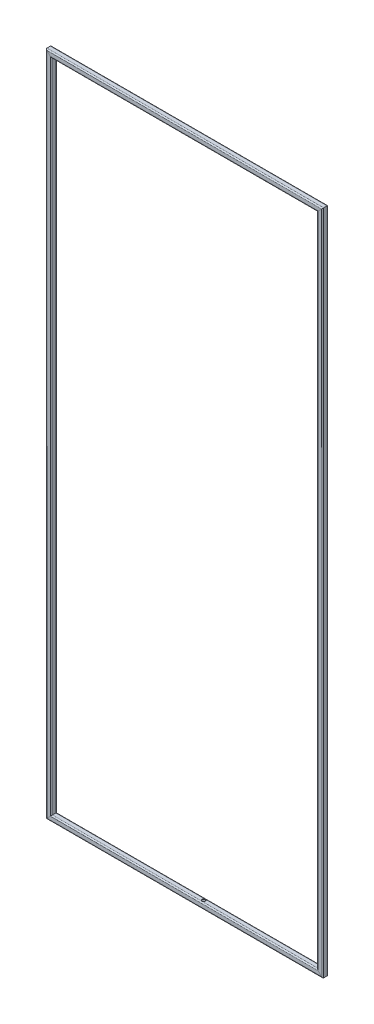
SolidWorks part; units mm, degrees
ref_plane "Piano frontale" through (0, 0, 0) normal (0, 0, 1) x (1, 0, 0)
ref_plane "Piano superiore" through (0, 0, 0) normal (0, 1, 0) x (1, 0, 0)
ref_plane "Piano destro" through (0, 0, 0) normal (1, 0, 0) x (0, 0, -1)
sketch "Schizzo1" plane through (0, 0, 0) normal (0, 0, 1) x (1, 0, 0)
  line L1 (490, -1195) -> (-490, -1195)
  line L2 (490, -1195) -> (490, 1195)
  line L3 (490, 1195) -> (-490, 1195)
  line L4 (-490, -1195) -> (-490, 1195)
  line L5 (490, -1195) -> (-490, 1195) construction
  line L6 (490, 1195) -> (-490, -1195) construction
  point P0 (0, 0)
  dimension "D1" = 980
  dimension "D2" = 2390
other "Tubo quadrato 20 X 20 X 2.0(1)"
ref_plane "Piano1" through (-490, -1195, 0) normal (0, 1, 0) x (-1, 0, 0)
sketch "Sketch1" plane through (-490, -1195, 0) normal (0, 1, 0) x (-1, 0, 0)
  line L0 (-6, -8) -> (6, -8)
  line L1 (-8, -6) -> (-8, 6)
  line L2 (6, 8) -> (-6, 8)
  line L3 (8, 6) -> (8, -6)
  line L4 (-6, -10) -> (6, -10)
  line L5 (-10, -6) -> (-10, 6)
  line L6 (6, 10) -> (-6, 10)
  line L7 (10, 6) -> (10, -6)
  line L8 (-10, 0) -> (-8, 0) construction
  line L9 (-8, 0) -> (8, 0) construction
  line L10 (8, 0) -> (10, 0) construction
  line L12 (0, 10) -> (0, 8) construction
  line L13 (0, 8) -> (0, -8) construction
  line L14 (0, -8) -> (0, -10) construction
  arc A0 (10, 6) -> (6, 10) centre (6, 6) ccw
  arc A1 (6, -10) -> (10, -6) centre (6, -6) ccw
  arc A2 (-10, -6) -> (-6, -10) centre (-6, -6) ccw
  arc A3 (-6, 10) -> (-10, 6) centre (-6, 6) ccw
  arc A4 (-6, 8) -> (-8, 6) centre (-6, 6) ccw
  arc A5 (8, 6) -> (6, 8) centre (6, 6) ccw
  arc A6 (6, -8) -> (8, -6) centre (6, -6) ccw
  arc A7 (-8, -6) -> (-6, -8) centre (-6, -6) ccw
  point P2 (-10, 10)
  point P33 (-10, -10)
  point P34 (10, -10)
  point P36 (10, 10)
  point P37 (0, 0)
  dimension "D1" = 4
  dimension "Thickness" = 2
  dimension "V_leg" = 20
  dimension "H_leg" = 20
sketch "Schizzo2" plane through (0, 1185, 0) normal (0, -1, 0) x (1, 0, 0)
  line L0 (0, 0) -> (-60, 0) construction
  circle A0 centre (-60, 0) radius 6
  dimension "D1" = 12
  dimension "D2" = 60
extrude "Taglio-Estrusione1" cut sketch "Schizzo2" against normal blind 5
sketch "Schizzo3" plane through (0, -1185, 0) normal (0, 1, 0) x (1, 0, 0)
  line L0 (60, 0) -> (0, 0) construction
  circle A0 centre (60, 0) radius 6
  dimension "D1" = 12
  dimension "D2" = 60
extrude "Taglio-Estrusione2" cut sketch "Schizzo3" against normal blind 5
sketch "Linee di piegatura1" [suppressed] plane through (0, 0, 0) normal (0, 1, 0) x (1, 0, 0)
sketch "Casella di contorno1" [suppressed] plane through (0, 0, 0) normal (0, 1, 0) x (1, 0, 0)
equation "\"Lam_vern\"= 2 * ( \"SW-Massa\" / \"SW-Densità\" ) / ( \"Spessore\" / 1000 )"
